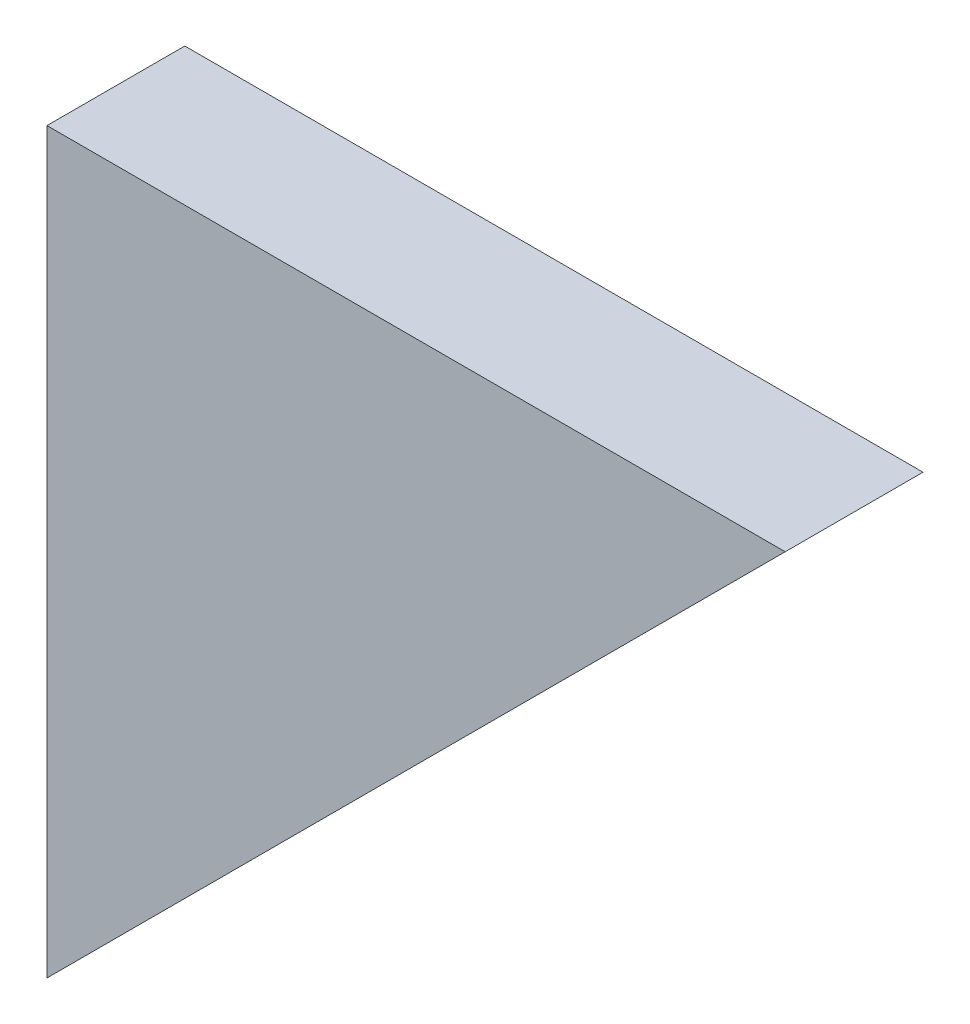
SolidWorks part; units mm, degrees
ref_plane "Piano frontale" through (0, 0, 0) normal (0, 0, 1) x (1, 0, 0)
ref_plane "Piano superiore" through (0, 0, 0) normal (0, 1, 0) x (1, 0, 0)
ref_plane "Piano destro" through (0, 0, 0) normal (1, 0, 0) x (0, 0, -1)
sketch "Schizzo1" plane through (0, 0, 0) normal (0, 0, 1) x (1, 0, 0)
  line L0 (-46.8677, 14.6053) -> (-46.8677, -15.3947)
  line L1 (-46.8677, -15.3947) -> (-16.8677, 14.6053)
  line L2 (-16.8677, 14.6053) -> (-46.8677, 14.6053)
  dimension "D1" = 30
  dimension "D2" = 30
extrude "Estrusione-Estrusione1" add sketch "Schizzo1" along normal blind 5.6
